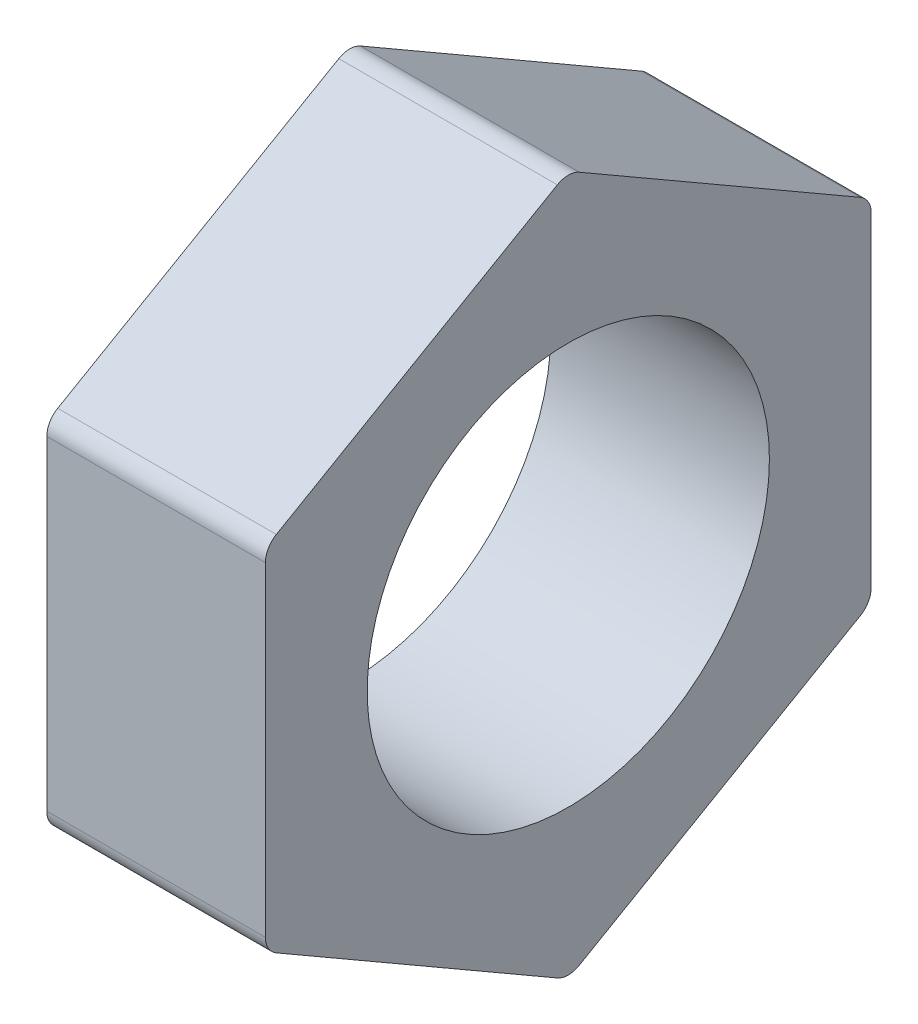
SolidWorks part; units mm, degrees
ref_plane "Front Plane" through (0, 0, 0) normal (0, 0, 1) x (1, 0, 0)
ref_plane "Top Plane" through (0, 0, 0) normal (0, 1, 0) x (1, 0, 0)
ref_plane "Right Plane" through (0, 0, 0) normal (1, 0, 0) x (0, 0, -1)
sketch "Sketch1" plane through (0, 0, 0) normal (1, 0, 0) x (0, 0, -1)
  line L0 (0, 0) -> (0, 8) construction
  line L1 (0, 0) -> (6.9282, 4) construction
  line L2 (0, 0) -> (6.9282, -4) construction
  line L3 (0, 0) -> (0, -8) construction
  line L4 (0, 0) -> (-6.9282, -4) construction
  line L5 (0, 0) -> (-6.9282, 4) construction
  line L6 (-6.6782, 4.1443) -> (-0.25, 7.8557)
  line L7 (0.25, 7.8557) -> (6.6782, 4.1443)
  line L8 (6.9282, 3.7113) -> (6.9282, -3.7113)
  line L9 (6.6782, -4.1443) -> (0.25, -7.8557)
  line L10 (-0.25, -7.8557) -> (-6.6782, -4.1443)
  line L11 (-6.9282, -3.7113) -> (-6.9282, 3.7113)
  circle A0 centre (0, 0) radius 8 construction
  arc A1 (-0.25, 7.8557) -> (0.25, 7.8557) centre (0, 7.4226) cw
  arc A2 (6.6782, 4.1443) -> (6.9282, 3.7113) centre (6.4282, 3.7113) cw
  arc A3 (6.9282, -3.7113) -> (6.6782, -4.1443) centre (6.4282, -3.7113) cw
  arc A4 (0.25, -7.8557) -> (-0.25, -7.8557) centre (0, -7.4226) cw
  arc A5 (-6.6782, -4.1443) -> (-6.9282, -3.7113) centre (-6.4282, -3.7113) cw
  arc A6 (-6.6782, 4.1443) -> (-6.9282, 3.7113) centre (-6.4282, 3.7113) ccw
  circle A7 centre (0, 0) radius 4.6
  point P11 (0, 0)
  dimension "D1" = 16
  dimension "D3" = 0.5
  dimension "D4" = 9.2
  dimension "D2" = 6
extrude "Boss-Extrude1" add sketch "Sketch1" along normal mid plane 5 contours L6 A6 L11 A5 L10 A4 L9 A3 L8 A2 L7 A1 A7
